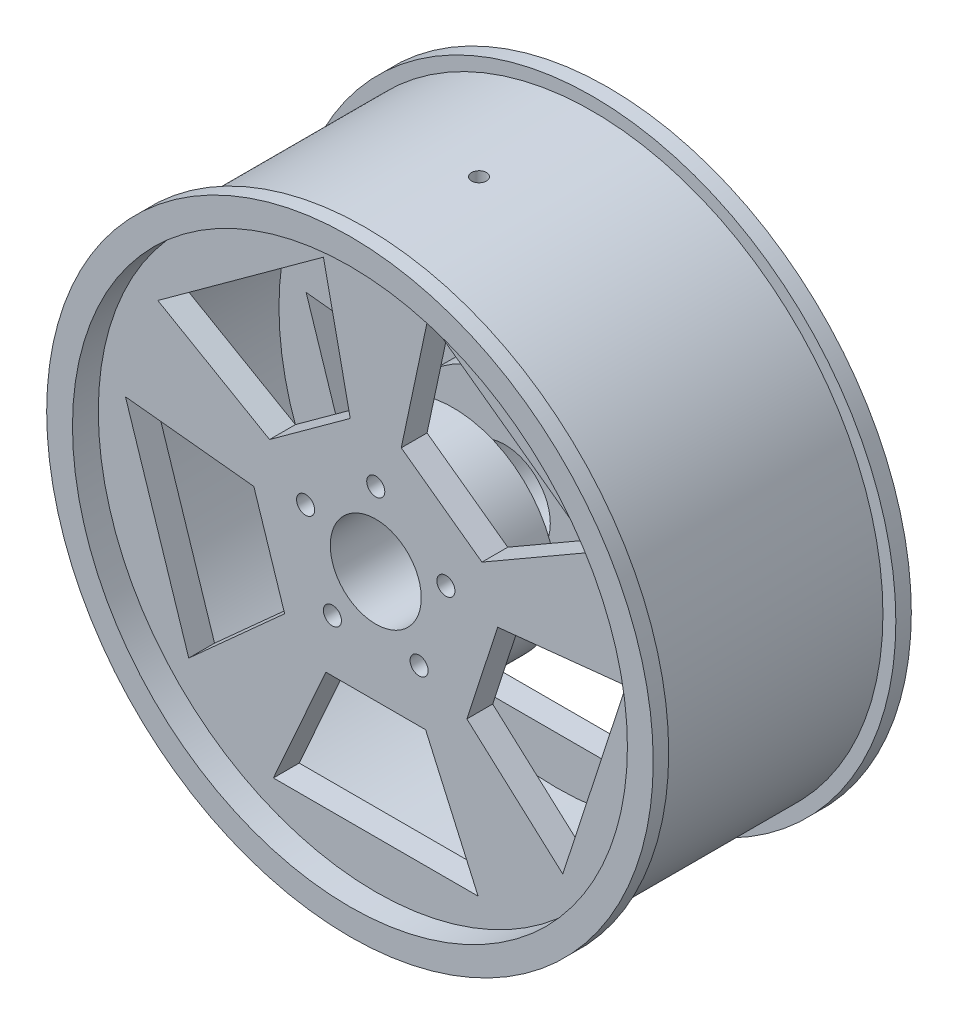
SolidWorks part; units mm, degrees
ref_plane "前视基准面" through (0, 0, 0) normal (0, 0, 1) x (1, 0, 0)
ref_plane "上视基准面" through (0, 0, 0) normal (0, 1, 0) x (1, 0, 0)
ref_plane "右视基准面" through (0, 0, 0) normal (1, 0, 0) x (0, 0, -1)
other "Configuration Table"
sketch "草图1" plane through (0, 0, 0) normal (1, 0, 0) x (0, 0, -1)
  line L0 (-40, 0) -> (200, 0) construction
  line L1 (0, 0) -> (0, 215)
  line L2 (0, 215) -> (-20, 215)
  line L3 (-20, 215) -> (-20, 235)
  line L4 (-20, 235) -> (-8, 235)
  line L5 (-8, 235) -> (-8, 225)
  line L6 (-8, 225) -> (168, 225)
  line L7 (168, 225) -> (168, 235)
  line L8 (168, 235) -> (180, 235)
  line L9 (180, 235) -> (180, 215)
  line L10 (180, 215) -> (160, 215)
  line L11 (160, 215) -> (160, 0)
  line L12 (160, 0) -> (100, 0)
  line L13 (100, 0) -> (100, 80)
  line L14 (100, 80) -> (140, 80)
  line L15 (140, 80) -> (140, 215)
  line L16 (140, 215) -> (20, 215)
  line L17 (20, 215) -> (20, 80)
  line L18 (20, 80) -> (60, 80)
  line L19 (60, 80) -> (60, 0)
  line L20 (60, 0) -> (0, 0)
revolve "01_REVOLVE_WHEEL" add sketch "草图1" angle 360 about L0
sketch "草图2" plane through (0, 0, 0) normal (0, 0, 1) x (1, 0, 0)
  line L0 (-19.7516, 92.924) -> (-40.5428, 190.7388)
  line L1 (-40.5428, 190.7388) -> (-168.875, 97.5)
  line L2 (-168.875, 97.5) -> (-82.2724, 47.5)
  line L3 (-82.2724, 47.5) -> (-19.7516, 92.924)
extrude "02_WINDOW_1" cut sketch "草图2" against normal through all
sketch "草图3" plane through (0, 0, 0) normal (0, 0, 1) x (1, 0, 0)
  line L0 (-94.4796, 9.9302) -> (-193.9318, 20.3831)
  line L1 (-193.9318, 20.3831) -> (-144.9132, -130.4805)
  line L2 (-144.9132, -130.4805) -> (-70.5988, -63.5674)
  line L3 (-70.5988, -63.5674) -> (-94.4796, 9.9302)
extrude "02_WINDOW_2" cut sketch "草图3" against normal through all
sketch "草图4" plane through (0, 0, 0) normal (0, 0, 1) x (1, 0, 0)
  line L0 (-38.64, -86.7868) -> (-79.3136, -178.1414)
  line L1 (-79.3136, -178.1414) -> (79.3136, -178.1414)
  line L2 (79.3136, -178.1414) -> (38.64, -86.7868)
  line L3 (38.64, -86.7868) -> (-38.64, -86.7868)
extrude "02_WINDOW_3" cut sketch "草图4" against normal through all
sketch "草图5" plane through (0, 0, 0) normal (0, 0, 1) x (1, 0, 0)
  line L0 (70.5988, -63.5674) -> (144.9132, -130.4805)
  line L1 (144.9132, -130.4805) -> (193.9318, 20.3831)
  line L2 (193.9318, 20.3831) -> (94.4796, 9.9302)
  line L3 (94.4796, 9.9302) -> (70.5988, -63.5674)
extrude "02_WINDOW_4" cut sketch "草图5" against normal through all
sketch "草图6" plane through (0, 0, 0) normal (0, 0, 1) x (1, 0, 0)
  line L0 (82.2724, 47.5) -> (168.875, 97.5)
  line L1 (168.875, 97.5) -> (40.5428, 190.7388)
  line L2 (40.5428, 190.7388) -> (19.7516, 92.924)
  line L3 (19.7516, 92.924) -> (82.2724, 47.5)
extrude "02_WINDOW_5" cut sketch "草图6" against normal through all
sketch "草图7" plane through (0, 0, 0) normal (0, 0, 1) x (1, 0, 0)
  circle A0 centre (0, 0) radius 35.25
  dimension "D1" = 70.5
extrude "03_BORE_D70.5" cut sketch "草图7" against normal through all
sketch "草图8" plane through (0, 0, 0) normal (0, 0, 1) x (1, 0, 0)
  circle A0 centre (0, 57.15) radius 7
  dimension "D1" = 14
extrude "04_BOLT_HOLE_D14_1" cut sketch "草图8" against normal through all
sketch "草图9" plane through (0, 0, 0) normal (0, 0, 1) x (1, 0, 0)
  circle A0 centre (-54.3529, 17.6603) radius 7
  dimension "D1" = 14
extrude "04_BOLT_HOLE_D14_2" cut sketch "草图9" against normal through all
sketch "草图10" plane through (0, 0, 0) normal (0, 0, 1) x (1, 0, 0)
  circle A0 centre (-33.5919, -46.2353) radius 7
  dimension "D1" = 14
extrude "04_BOLT_HOLE_D14_3" cut sketch "草图10" against normal through all
sketch "草图11" plane through (0, 0, 0) normal (0, 0, 1) x (1, 0, 0)
  circle A0 centre (33.5919, -46.2353) radius 7
  dimension "D1" = 14
extrude "04_BOLT_HOLE_D14_4" cut sketch "草图11" against normal through all
sketch "草图12" plane through (0, 0, 0) normal (0, 0, 1) x (1, 0, 0)
  circle A0 centre (54.3529, 17.6603) radius 7
  dimension "D1" = 14
extrude "04_BOLT_HOLE_D14_5" cut sketch "草图12" against normal through all
ref_plane "Plane_Valve" through (0, 225, 0) normal (0, 1, 0) x (1, 0, 0)
sketch "草图13" plane through (0, 225, 0) normal (0, 1, 0) x (1, 0, 0)
  circle A0 centre (0, 80) radius 5.75
  dimension "D1" = 11.5
extrude "05_VALVE_HOLE_D11.5" cut sketch "草图13" against normal blind 20
